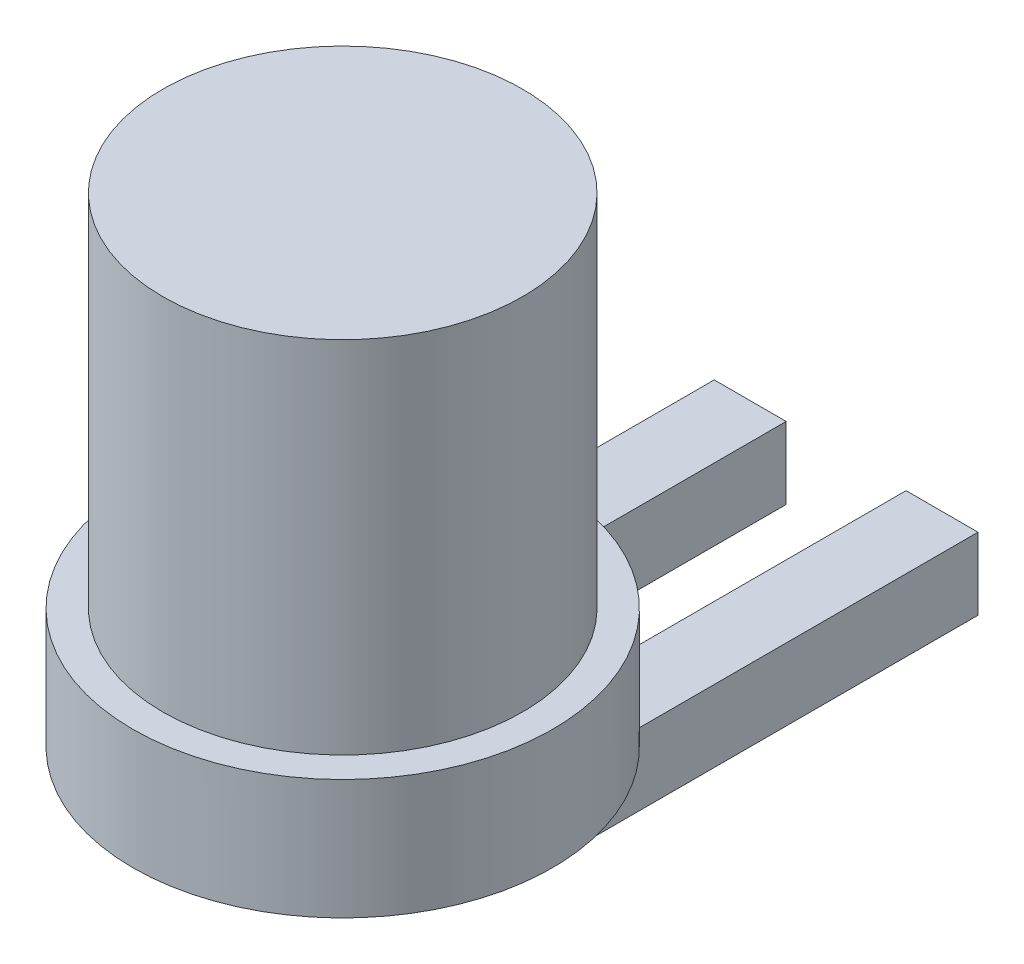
SolidWorks part; units mm, degrees
ref_plane "Ebene vorne" through (0, 0, 0) normal (0, 0, 1) x (1, 0, 0)
ref_plane "Ebene oben" through (0, 0, 0) normal (0, 1, 0) x (1, 0, 0)
ref_plane "Ebene rechts" through (0, 0, 0) normal (1, 0, 0) x (0, 0, -1)
sketch "Skizze1" plane through (0, 0, 0) normal (0, 0, 1) x (1, 0, 0)
  line L0 (0, 65.137) -> (0, -51.9873) construction
  line L1 (0, 0) -> (-1.75, 0)
  line L2 (-1.75, 0) -> (-1.75, 1)
  line L3 (-1.75, 1) -> (-1.5, 1)
  line L4 (-1.5, 1) -> (-1.5, 4)
  line L5 (-1.5, 4) -> (0, 4)
  line L6 (0, 4) -> (0, 0)
  dimension "D1" = 3
  dimension "D2" = 3
  dimension "D3" = 3.5
  dimension "D4" = 1
revolve "Rotation1" add sketch "Skizze1" angle 360 about L0
sketch "Skizze2" plane through (0, 0, 0) normal (0, -1, 0) x (1, 0, 0)
  line L0 (0, 2.1138) -> (0, -3.4404) construction
  line L1 (-1.1, 0.4086) -> (-0.5, 0.4086)
  line L2 (-1.1, 0.4086) -> (-1.1, -4.1984)
  line L3 (-1.1, -4.1984) -> (-0.5, -4.1984)
  line L4 (-0.5, 0.4086) -> (-0.5, -4.1984)
  line L5 (0.5, 0.4086) -> (1.1, 0.4086)
  line L6 (0.5, 0.4086) -> (0.5, -4.1984)
  line L7 (0.5, -4.1984) -> (1.1, -4.1984)
  line L8 (1.1, 0.4086) -> (1.1, -4.1984)
  dimension "D1" = 0.6
  dimension "D2" = 0.6
  dimension "D3" = 1
extrude "Aufsatz-Linear austragen1" add sketch "Skizze2" along normal blind 0.6
fillet "Verrundung1" radius 0.8 2 edges at (-0.8, -0.6, 0.4086) (0.8, -0.6, 0.4086)
